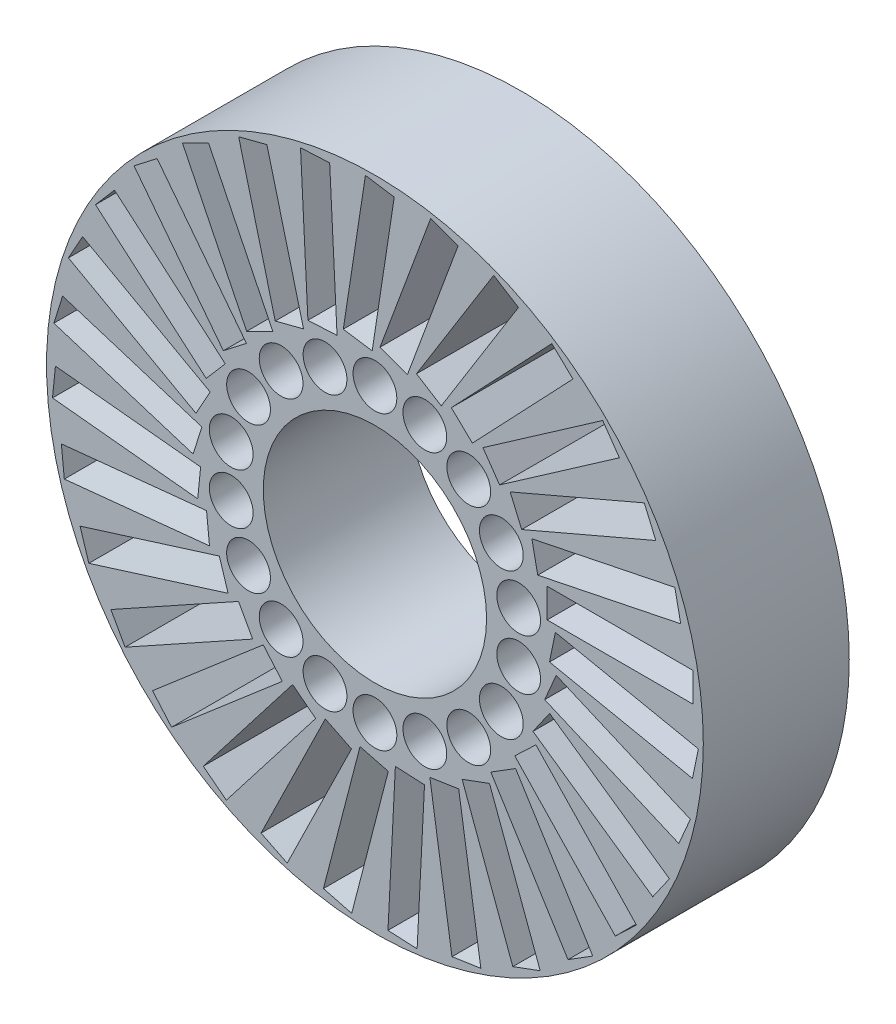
SolidWorks part; units mm, degrees
ref_plane "Front Plane" through (0, 0, 0) normal (0, 0, 1) x (1, 0, 0)
ref_plane "Top Plane" through (0, 0, 0) normal (0, 1, 0) x (1, 0, 0)
ref_plane "Right Plane" through (0, 0, 0) normal (1, 0, 0) x (0, 0, -1)
sketch "Sketch1" plane through (0, 0, 0) normal (0, 0, 1) x (1, 0, 0)
  circle A0 centre (0, 0) radius 57.15
  dimension "D1" = 114.3
extrude "Boss-Extrude1" add sketch "Sketch1" along normal blind 25.4
sketch "Sketch2" plane through (0, 0, 0) normal (0, 0, 1) x (1, 0, 0)
  circle A0 centre (0, 0) radius 19.431
  dimension "D1" = 38.862
extrude "Cut-Extrude1" cut sketch "Sketch2" along normal blind 35.56
sketch "Sketch4" plane through (0, 0, 0) normal (0, 0, 1) x (1, 0, 0)
  line L1 (55.372, 10.16) -> (29.972, 10.16)
  line L2 (55.372, 10.16) -> (55.372, 5.08)
  line L3 (55.372, 5.08) -> (29.972, 5.08)
  line L4 (29.972, 10.16) -> (29.972, 5.08)
  dimension "D1" = 5.08
  dimension "D2" = 25.4
  dimension "D3" = 29.972
  dimension "D4" = 5.08
extrude "Cut-Extrude7" cut sketch "Sketch4" along normal through all
pattern_circular "CirPattern1" count 31 over 360 about axis through (0, 0, 0) along (0, 0, 1) of "Cut-Extrude7"
sketch "Sketch5" plane through (0, 0, 0) normal (0, 0, 1) x (1, 0, 0)
  circle A0 centre (0, 0) radius 25.4
  circle A1 centre (0, 25.4) radius 3.81
  dimension "D1" = 50.8
  dimension "D2" = 7.62
extrude "Cut-Extrude8" cut sketch "Sketch5" along normal through all contours A1
pattern_circular "CirPattern3" count 18 over 360 about axis through (0, 0, 0) along (0, 0, 1) of "Cut-Extrude8"
